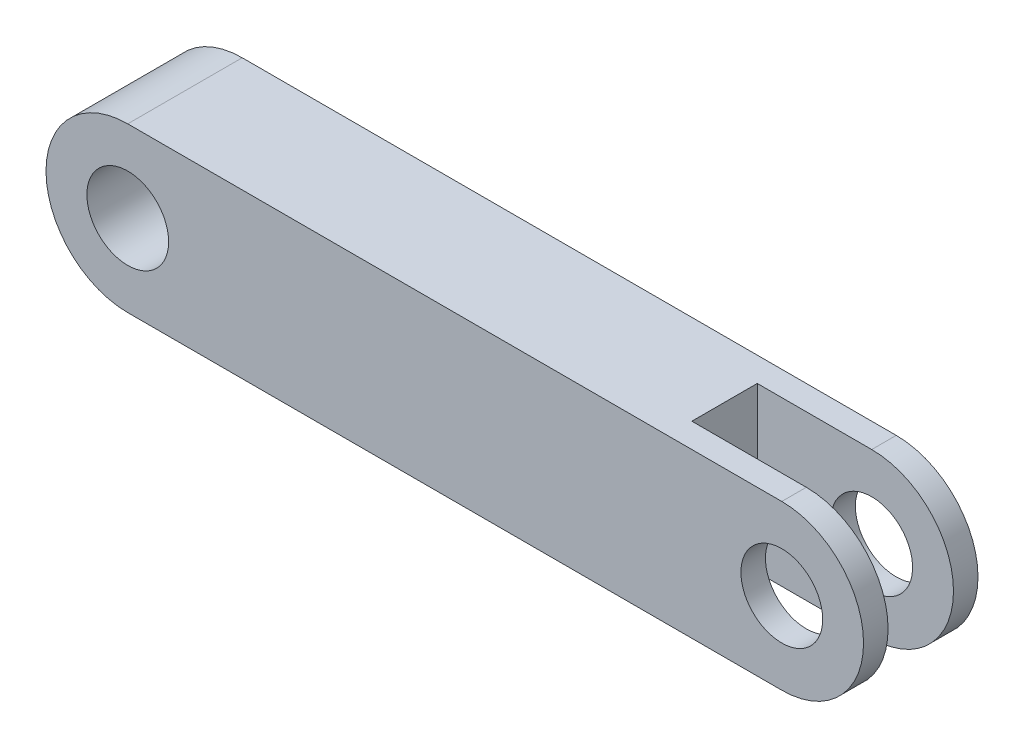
SolidWorks part; units mm, degrees
ref_plane "Front Plane" through (0, 0, 0) normal (0, 0, 1) x (1, 0, 0)
ref_plane "Top Plane" through (0, 0, 0) normal (0, 1, 0) x (1, 0, 0)
ref_plane "Right Plane" through (0, 0, 0) normal (1, 0, 0) x (0, 0, -1)
sketch "Sketch1" plane through (0, 0, 0) normal (0, 0, 1) x (1, 0, 0)
  line L0 (0, 0) -> (40, 0)
  line L1 (40, -10) -> (0, -10)
  arc A0 (40, 0) -> (40, -10) centre (40, -5) cw
  arc A1 (0, -10) -> (0, 0) centre (0, -5) cw
  circle A2 centre (0, -5) radius 2.5
  circle A3 centre (40, -5) radius 2.5
  dimension "D1" = 5
  dimension "D2" = 5
  dimension "D3" = 40
extrude "Extrude2" add sketch "Sketch1" along normal mid plane 7
sketch "Sketch2" plane through (0, 0, 0) normal (0, 1, 0) x (-1, 0, 0)
  line L0 (-45, 0) -> (-33, 0) construction
  line L1 (-45, 3.5) -> (-45, -3.5) construction
  line L2 (-45, -2) -> (-33, -2)
  line L3 (-45, 2) -> (-33, 2)
  line L4 (-45, -2) -> (-45, 2)
  line L5 (-33, -2) -> (-33, 2)
  dimension "D1" = 12
  dimension "D2" = 2
  dimension "D3" = 2
extrude "Cut-Extrude1" cut sketch "Sketch2" against normal up to next
